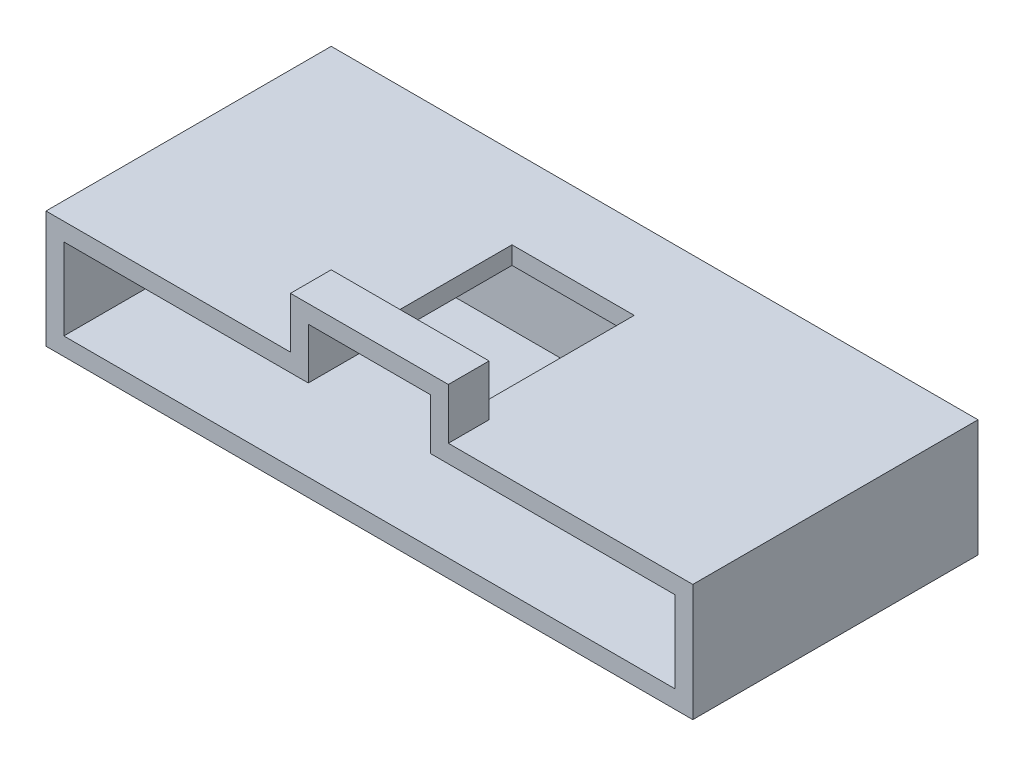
SolidWorks part; units mm, degrees
ref_plane "Front" through (0, 0, 0) normal (0, 0, 1) x (1, 0, 0)
ref_plane "Top" through (0, 0, 0) normal (0, 1, 0) x (1, 0, 0)
ref_plane "Right" through (0, 0, 0) normal (1, 0, 0) x (0, 0, -1)
sketch "Sketch1" plane through (0, 0, 0) normal (0, 0, 1) x (1, 0, 0)
  line L1 (0, 0) -> (25.4, 0)
  line L2 (0, 0) -> (0, 4.6)
  line L3 (0, 4.6) -> (25.4, 4.6)
  line L4 (25.4, 0) -> (25.4, 4.6)
  dimension "D1" = 4.6
  dimension "D2" = 25.4
extrude "Boss-Extrude1" add sketch "Sketch1" along normal blind 11.2
sketch "Sketch2" plane through (0, 0, 11.2) normal (0, 0, 1) x (1, 0, 0)
  line L0 (25.4, 4.6) -> (0, 4.6) construction
  line L1 (0.7, 3.9) -> (24.7, 3.9)
  line L2 (0.7, 3.9) -> (0.7, 0.7)
  line L3 (0.7, 0.7) -> (24.7, 0.7)
  line L4 (24.7, 3.9) -> (24.7, 0.7)
  line L5 (0, 4.6) -> (0, 0) construction
  line L6 (0, 0) -> (25.4, 0) construction
  line L7 (25.4, 0) -> (25.4, 4.6) construction
  dimension "D1" = 0.7
  dimension "D2" = 0.7
  dimension "D3" = 0.7
  dimension "D4" = 0.7
extrude "Cut-Extrude1" cut sketch "Sketch2" against normal blind 9
sketch "Sketch3" plane through (0, 0, 11.2) normal (0, 0, 1) x (1, 0, 0)
  line L0 (24.7, 3.9) -> (0.7, 3.9) construction
  line L1 (9.6, 3.9) -> (15.8, 3.9)
  line L2 (9.6, 3.9) -> (9.6, 6.6)
  line L3 (9.6, 6.6) -> (15.8, 6.6)
  line L4 (15.8, 3.9) -> (15.8, 6.6)
  line L5 (0, 4.6) -> (0, 0) construction
  dimension "D1" = 2.7
  dimension "D2" = 6.2
  dimension "D3" = 9.6
extrude "Boss-Extrude2" add sketch "Sketch3" against normal blind 1.6
sketch "Sketch4" plane through (0, 0, 11.2) normal (0, 0, 1) x (1, 0, 0)
  line L0 (24.7, 3.9) -> (0.7, 3.9) construction
  line L1 (10.3, 5.9) -> (15.1, 5.9)
  line L2 (10.3, 5.9) -> (10.3, 3.9)
  line L3 (10.3, 3.9) -> (15.1, 3.9)
  line L4 (15.1, 5.9) -> (15.1, 3.9)
  line L5 (9.6, 6.6) -> (9.6, 4.6) construction
  line L6 (15.8, 4.6) -> (15.8, 6.6) construction
  line L7 (15.8, 6.6) -> (9.6, 6.6) construction
  dimension "D1" = 0.7
  dimension "D2" = 0.7
  dimension "D3" = 0.7
extrude "Cut-Extrude2" cut sketch "Sketch4" against normal blind 8
equation "\"D2@Sketch2\"=\"D1@Sketch2\""
equation "\"D3@Sketch2\"=\"D1@Sketch2\""
equation "\"D4@Sketch2\"=\"D1@Sketch2\""
equation "\"D2@Sketch4\"=\"D1@Sketch4\""
equation "\"D3@Sketch4\"=\"D1@Sketch4\""
